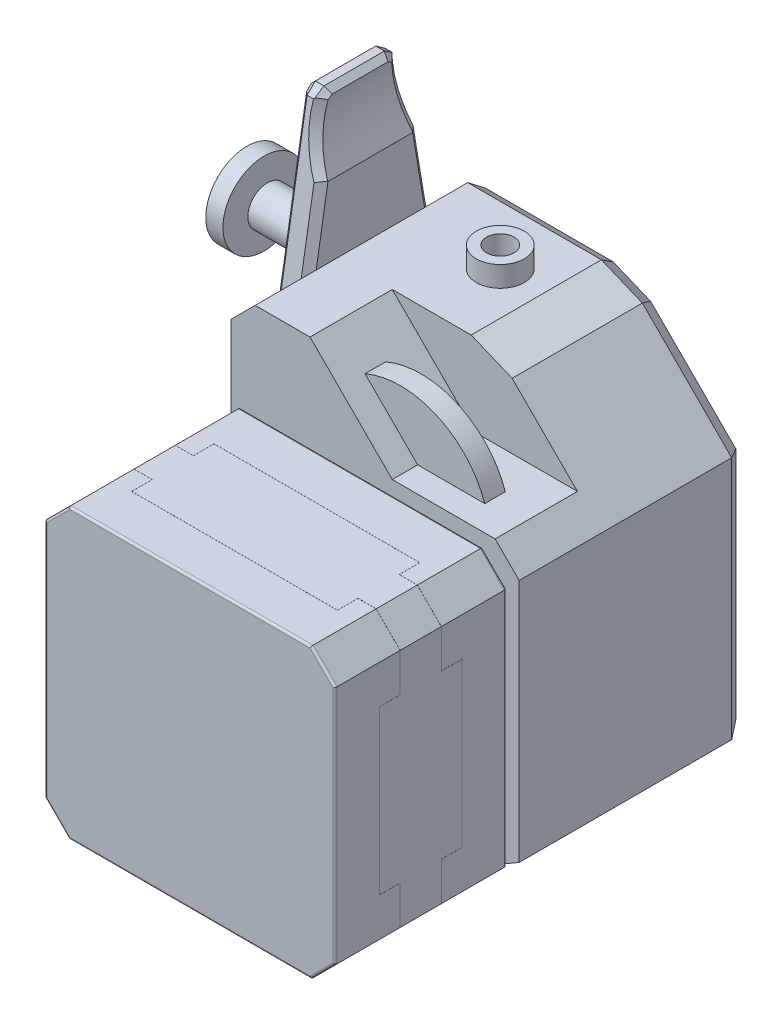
SolidWorks part; units mm, degrees
ref_plane "Front Plane" through (0, 0, 0) normal (0, 0, 1) x (1, 0, 0)
ref_plane "Top Plane" through (0, 0, 0) normal (0, 1, 0) x (1, 0, 0)
ref_plane "Right Plane" through (0, 0, 0) normal (1, 0, 0) x (0, 0, -1)
imported_body "Mini_geared-1-solid1"
imported_body "Mini_geared-1-solid2"
imported_body "Mini_geared-1-solid3"
imported_body "Mini_geared-1-solid4"
imported_body "Mini_geared-1-solid5"
imported_body "Mini_geared-1-solid6"
imported_body "Mini_geared-1-solid7"
imported_body "Mini_geared-1-solid8"
imported_body "115327186-686825-BMG_Extruder-1-solid1"
move or copy body "Body-Move/Copy1" bodies to move or copy 101 103 102 copy no translate (0, 0, -2)
